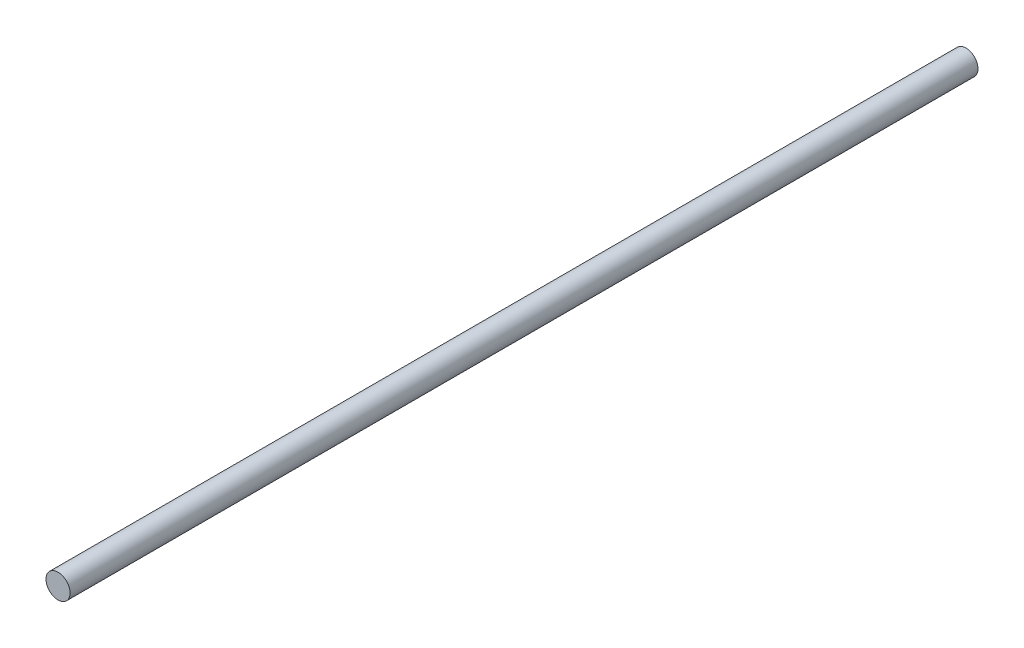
SolidWorks part; units mm, degrees
ref_plane "Alzado" through (0, 0, 0) normal (0, 0, 1) x (1, 0, 0)
ref_plane "Planta" through (0, 0, 0) normal (0, 1, 0) x (1, 0, 0)
ref_plane "Vista lateral" through (0, 0, 0) normal (1, 0, 0) x (0, 0, -1)
sketch "Croquis1" plane through (0, 0, 0) normal (0, 0, 1) x (1, 0, 0)
  circle A0 centre (0, 0) radius 2.5
  dimension "D1" = 5
extrude "Saliente-Extruir1" add sketch "Croquis1" along normal blind 188.4
